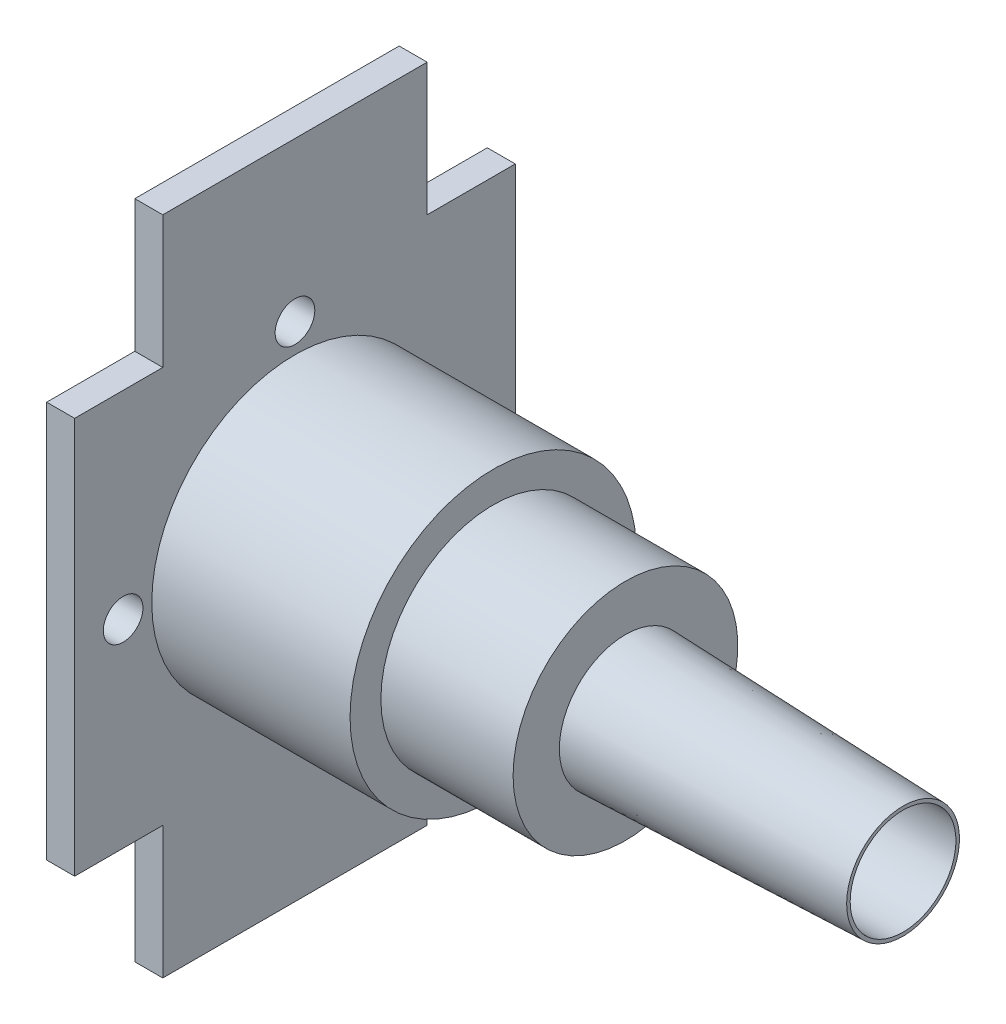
SolidWorks part; units mm, degrees
ref_plane "Front Plane" through (0, 0, 0) normal (0, 0, 1) x (1, 0, 0)
ref_plane "Top Plane" through (0, 0, 0) normal (0, 1, 0) x (1, 0, 0)
ref_plane "Right Plane" through (0, 0, 0) normal (1, 0, 0) x (0, 0, -1)
sketch "Sketch1" plane through (0, 0, 0) normal (1, 0, 0) x (0, -1, 0)
  line L1 (-75, -50) -> (75, -50)
  line L2 (-75, -50) -> (-75, 50)
  line L3 (-75, 50) -> (75, 50)
  line L4 (75, -50) -> (75, 50)
  line L5 (-75, -50) -> (75, 50) construction
  line L6 (-75, 50) -> (75, -50) construction
  dimension "D1" = 150
  dimension "D2" = 100
extrude "Boss-Extrude1" add sketch "Sketch1" along normal blind 6.35
sketch "Sketch5" plane through (0, 0, 0) normal (0, 0, 1) x (1, 0, 0)
  line L0 (6.35, 0) -> (81.35, 0)
  line L1 (6.35, 75) -> (6.35, -75) construction
  line L2 (51.35, -32.5) -> (51.35, -25.5)
  line L3 (51.35, -25.5) -> (81.35, -25.5)
  line L4 (81.35, -25.5) -> (81.35, 0)
  line L5 (51.35, -32.5) -> (6.35, -32.5)
  line L6 (6.35, -32.5) -> (6.35, 0)
  line L8 (6.35, 0) -> (99.4306, 0) construction
  dimension "D1" = 75
  dimension "D2" = 65
  dimension "D3" = 7
  dimension "D4" = 45
revolve "Revolve1" add sketch "Sketch5" angle 360 about L0
sketch "Sketch2" plane through (6.35, 0, 0) normal (1, 0, 0) x (0, -1, 0)
  line L0 (-39, 0) -> (0, 0) construction
  circle A1 centre (-39, 0) radius 4.5
  dimension "D1" = 39
  dimension "D2" = 9
extrude "Cut-Extrude1" cut sketch "Sketch2" against normal through all
sketch "Sketch6" plane through (81.35, 0, 0) normal (-1, 0, 0) x (0, 1, 0)
  circle A0 centre (0, 0) radius 15
  circle A3 centre (0, 0) radius 25.5 construction
  dimension "D2" = 30
pattern_circular "CirPattern1" count 4 over 360 about axis through (0, 0, 0) along (1, 0, 0) of "Cut-Extrude1"
extrude "Boss-Extrude2" add sketch "Sketch6" against normal blind 63 draft 2
sketch "Sketch8" plane through (6.35, 0, 0) normal (1, 0, 0) x (0, 0, -1)
  line L1 (-30, 45) -> (-50, 45)
  line L2 (-30, 45) -> (-30, 75)
  line L3 (-30, 75) -> (-50, 75)
  line L4 (-50, 45) -> (-50, 75)
  line L5 (-30, 45) -> (-50, 75) construction
  line L6 (-30, 75) -> (-50, 45) construction
  point P0 (-40, 60)
  dimension "D1" = 30
  dimension "D2" = 20
extrude "Cut-Extrude3" cut sketch "Sketch8" against normal through all
pattern_linear "LPattern1" count 2 spacing 120 along (0, -1, 0) count 2 spacing 80 along (0, 0, -1) of "Cut-Extrude3"
sketch "Sketch9" plane through (0, 0, 0) normal (0, 0, 1) x (1, 0, 0)
  line L0 (144.35, 12) -> (114.35, 12)
  line L1 (144.35, -12.8) -> (144.35, 12.8) construction
  line L2 (114.35, 12) -> (114.35, 11)
  line L3 (114.35, 11) -> (81.35, 11)
  line L4 (81.35, -25.5) -> (81.35, 25.5) construction
  line L5 (81.35, 11) -> (81.35, 0)
  line L6 (81.35, 0) -> (144.35, 0)
  line L7 (144.35, 0) -> (144.35, 12)
  dimension "D1" = 30
  dimension "D2" = 12
  dimension "D3" = 11
revolve "Cut-Revolve1" cut sketch "Sketch9" angle 360 about L6
